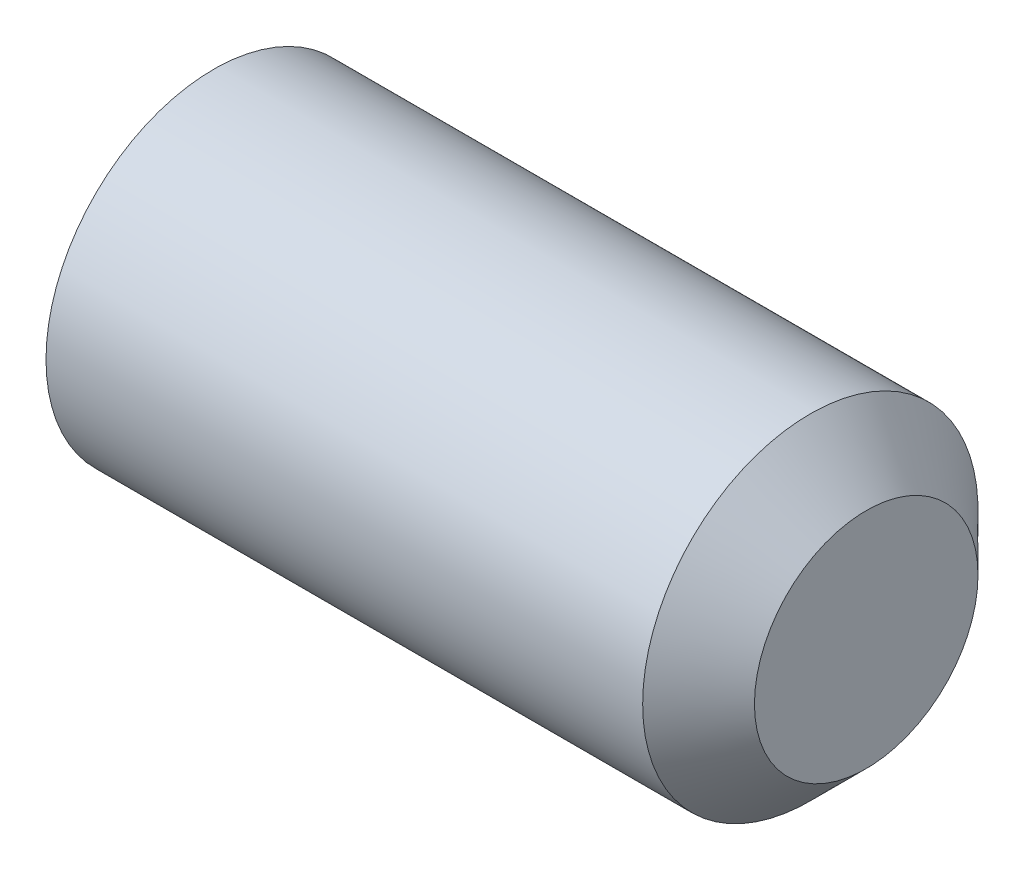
SolidWorks part; units mm, degrees
ref_plane "Plane1" through (0, 0, 0) normal (0, 0, 1) x (1, 0, 0)
ref_plane "Plane2" through (0, 0, 0) normal (0, 1, 0) x (1, 0, 0)
ref_plane "Plane3" through (0, 0, 0) normal (1, 0, 0) x (0, 0, -1)
sketch "BodySke" plane through (0, 0, 0) normal (0, 0, 1) x (1, 0, 0)
  line L0 (0, 0) -> (0, 1.2195)
  line L1 (0, 1.2195) -> (0.1619, 1.5)
  line L2 (0.1619, 1.5) -> (5.5, 1.5)
  line L3 (5.5, 1.5) -> (6, 1)
  line L4 (6, 0) -> (0, 0)
  line L5 (-12.7, 0) -> (88.9, 0) construction
  line L6 (6, 1) -> (6, 0)
  line L7 (6, 1) -> (6, 10.525) construction
  line L8 (0, -1.2195) -> (0.1619, -1.5) construction
  line L9 (0.5, 15.875) -> (0.5, -3.175) construction
  line L10 (5.5, -1.5) -> (6, -1) construction
  dimension "Length" = 6
  dimension "Diameter" = 3
  dimension "Drive_ch_ang" = 60
  dimension "Minor_dia" = 2.439
  dimension "Cup_nose_ang" = 45
  dimension "Cup_dia" = 2
  dimension "Advance" = 0.5
revolve "BaseBody" add sketch "BodySke" angle 360 about L5
sketch "Sketch2" plane through (0, 0, 0) normal (-1, 0, 0) x (0, 0, 1)
  line L0 (0.433, 0.75) -> (-0.433, 0.75)
  line L1 (-0.433, 0.75) -> (-0.866, 0)
  line L2 (0.433, 0.75) -> (0.866, 0)
  line L3 (0.433, -0.75) -> (0.866, 0)
  line L4 (0.433, -0.75) -> (-0.433, -0.75)
  line L5 (-0.433, -0.75) -> (-0.866, 0)
  dimension "Hex_size" = 1.5
  dimension "D2" = 0.75
  dimension "D3" = 0.75
extrude "Hex" cut sketch "Sketch2" against normal blind 2.1
sketch "Sketch4" plane through (0, 4.7709, -0.5249) normal (-1, 0, 0) x (0, 0, 1)
  line L0 (0.5249, -4.7709) -> (1.3124, -4.7709)
  line L1 (0.5249, -4.7709) -> (6.6732, -1.2211) construction
  line L2 (0.5249, -4.7709) -> (0.9186, -4.0889)
  line L3 (1.153, -4.6137) -> (1.2782, -4.5415)
  line L4 (0.975, -4.3054) -> (1.1002, -4.2332)
  arc A0 (1.153, -4.6137) -> (0.975, -4.3054) centre (0.5249, -4.7709) ccw
  arc A1 (1.3124, -4.7709) -> (1.2782, -4.5415) centre (0.5249, -4.7709) ccw
  arc A2 (0.9186, -4.0889) -> (1.1002, -4.2332) centre (0.5249, -4.7709) cw
  circle A3 centre (0.5249, -4.7709) radius 0.6475 construction
  circle A4 centre (0.5249, -4.7709) radius 0.7875 construction
  dimension "D1" = 30
  dimension "Spline_n_dim" = 1.295
  dimension "Spline_m_dim" = 1.575
  dimension "Spline_a_dim" = 60
  dimension "D3" = 0.178
  dimension "Spline_p_dim" = 0.356
extrude "Spline6" [suppressed] cut sketch "Sketch4" against normal blind 1.2
pattern_circular "CirPattern1" [suppressed] count 6 every 60 about axis through (-12.7, 0, 0) along (1, 0, 0)
sketch "Sketch5" plane through (0, 0.6556, 6.6316) normal (-1, 0, 0) x (0, 0, 1)
  line L0 (-6.6316, -0.6556) -> (-5.8441, -0.6556)
  line L1 (-6.6316, -0.6556) -> (-1.6115, 4.3645) construction
  line L2 (-6.6316, -0.6556) -> (-6.6316, 0.1319)
  line L3 (-6.0479, -0.3236) -> (-5.9633, -0.239)
  line L4 (-6.2996, -0.0719) -> (-6.215, 0.0127)
  line L5 (-6.2996, -0.0719) -> (-6.0479, -0.3236)
  arc A1 (-5.8441, -0.6556) -> (-5.9633, -0.239) centre (-6.6316, -0.6556) ccw
  arc A2 (-6.6316, 0.1319) -> (-6.215, 0.0127) centre (-6.6316, -0.6556) cw
  circle A3 centre (-6.6316, -0.6556) radius 0.6475 construction
  circle A4 centre (-6.6316, -0.6556) radius 0.7875 construction
  dimension "D1" = 45
  dimension "Spline_n_dim" = 1.295
  dimension "Spline_m_dim" = 1.575
  dimension "Spline_a_dim" = 90
  dimension "D3" = 0.178
  dimension "Spline_p_dim" = 0.356
extrude "Spline4" [suppressed] cut sketch "Sketch5" against normal blind 1.2
pattern_circular "CirPattern2" [suppressed] count 4 every 90 about axis through (-12.7, 0, 0) along (1, 0, 0)
sketch "ThdSchSke" plane through (0, 0, 0) normal (0, 0, 1) x (1, 0, 0)
  line L0 (0.1619, -1.2195) -> (-0.0345, -1.5)
  line L1 (0.1619, -1.2195) -> (0.3584, -1.5)
  line L2 (0.3584, -1.5) -> (0.3584, -1.875)
  line L3 (-3.175, 0) -> (5.1513, 0) construction
  line L4 (0.1619, 1.5) -> (0.1619, -1.5) construction
  line L5 (0.3584, -1.875) -> (-0.0345, -1.875)
  line L6 (-0.0345, -1.875) -> (-0.0345, -1.5)
  dimension "Thread_minor" = 2.439
  dimension "Diameter" = 3
  dimension "SideAngle" = 55
  dimension "VeeAngle" = 70
  dimension "Overcut" = 3.75
revolve "ThreadSchematic" [suppressed] cut sketch "ThdSchSke" angle 360 about L3
pattern_linear "ThdSchPat" [suppressed]
equation "\"D2@Sketch2\" = \"Hex_size@Sketch2\" / 2"
equation "\"D3@Sketch2\" = \"Hex_size@Sketch2\" / 2"
equation "\"Thread_minor@ThreadCosmetic\" = \"Minor_dia@BodySke\""
equation "\"D1@Sketch4\" = \"Spline_a_dim@Sketch4\" / 2"
equation "\"D3@Sketch4\" = \"Spline_p_dim@Sketch4\" / 2"
equation "\"D2@CirPattern1\" = \"Spline_a_dim@Sketch4\""
equation "\"Num_teeth@CirPattern1\" = 360 / \"D2@CirPattern1\""
equation "\"Spline_a_dim@Sketch5\" = 90"
equation "\"Spline_p_dim@Sketch5\" = \"Spline_p_dim@Sketch4\""
equation "\"Spline_m_dim@Sketch5\" = \"Spline_m_dim@Sketch4\""
equation "\"Spline_n_dim@Sketch5\" = \"Spline_n_dim@Sketch4\""
equation "\"D1@Sketch5\" = \"Spline_a_dim@Sketch5\" / 2"
equation "\"D3@Sketch5\" = \"Spline_p_dim@Sketch5\" / 2"
equation "\"Key_eng@Spline4\" = \"Key_eng@Spline6\""
equation "\"Thread_minor@ThdSchSke\" = \"Thread_minor@ThreadCosmetic\""
equation "\"Diameter@ThdSchSke\" = \"Diameter@BodySke\""
equation "\"Overcut@ThdSchSke\" = \"Diameter@BodySke\" * 1.25"
equation "\"Num_threads@ThdSchPat\" = int( (\"Length@BodySke\" - ( ( ( \"Diameter@BodySke\" - \"Minor_dia@BodySke\" ) * 0.5 ) / tan( \"Drive_ch_ang@BodySke\" * 0.017453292 ) ) - ( ( ( \"Diameter@BodySke\" - \"Cup_dia@BodySk"
equation "\"Advance@ThdSchPat\" = (\"Length@BodySke\" - ( ( ( \"Diameter@BodySke\" - \"Minor_dia@BodySke\" ) * 0.5 ) / tan( \"Drive_ch_ang@BodySke\" * 0.017453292 ) ) - ( ( ( \"Diameter@BodySke\" - \"Cup_dia@BodySke\" ) * 0."
equation "' \"Num_threads@ThdSchPat\" = \"Num_threads@ThdSchPat\" - sgn( \"Num_threads@ThdSchPat\" - 1) '---chamfered tips only---"
